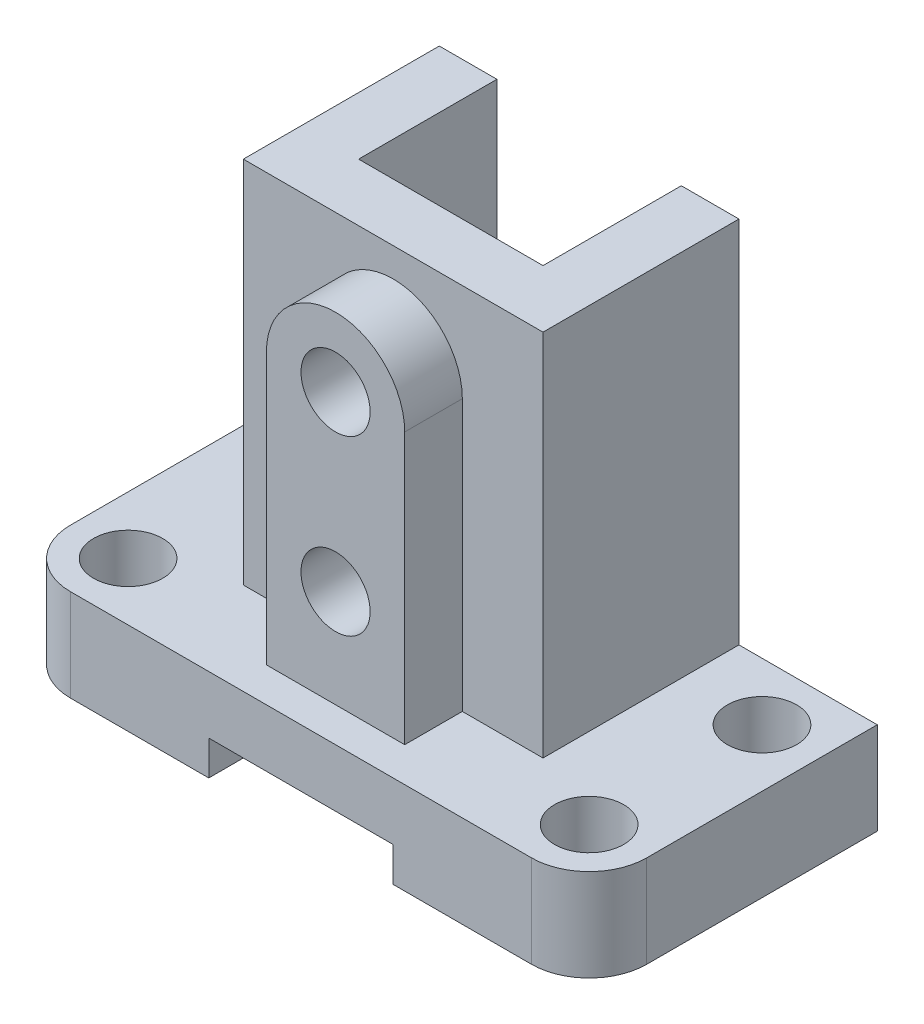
SolidWorks part; units mm, degrees
ref_plane "前视基准面" through (0, 0, 0) normal (0, 0, 1) x (1, 0, 0)
ref_plane "上视基准面" through (0, 0, 0) normal (0, 1, 0) x (1, 0, 0)
ref_plane "右视基准面" through (0, 0, 0) normal (1, 0, 0) x (0, 0, -1)
sketch "草图1" plane through (0, 0, 0) normal (0, 1, 0) x (1, 0, 0)
  line L0 (-24.746, -4.513) -> (34.5172, -4.513) construction
  line L1 (-100, 45.487) -> (100, 45.487)
  line L2 (-100, 45.487) -> (-100, -34.513)
  line L3 (-80, -54.513) -> (80, -54.513)
  line L4 (100, 45.487) -> (100, -34.513)
  line L5 (0, 32.2774) -> (0, -29.7669) construction
  arc A0 (80, -54.513) -> (100, -34.513) centre (80, -34.513) ccw
  arc A1 (-80, -54.513) -> (-100, -34.513) centre (-80, -34.513) cw
  point P11 (100, -54.513)
  point P14 (-100, -54.513)
  dimension "D3" = 20
  dimension "D1" = 100
  dimension "D2" = 200
extrude "拉伸1" add sketch "草图1" along normal blind 32
sketch "草图2" plane through (0, 32, 0) normal (0, 1, 0) x (1, 0, 0)
  circle A0 centre (80, -34.513) radius 12
  circle A1 centre (80, 25.487) radius 12
  dimension "D1" = 60
extrude "切除-拉伸1" cut sketch "草图2" against normal through all
mirror "镜向1" about plane through (0, 0, 0) normal (1, 0, 0) of "切除-拉伸1"
sketch "草图3" plane through (0, 32, 0) normal (0, 1, 0) x (1, 0, 0)
  line L0 (-52, 45.487) -> (-52, -22.513)
  line L1 (100, 45.487) -> (-100, 45.487) construction
  line L2 (-52, -22.513) -> (52, -22.513)
  line L3 (52, -22.513) -> (52, 45.487)
  line L4 (-32, 45.487) -> (-32, -2.513)
  line L5 (-32, -2.513) -> (32, -2.513)
  line L6 (32, -2.513) -> (32, 45.487)
  line L7 (-52, 45.487) -> (-32, 45.487)
  line L8 (32, 45.487) -> (52, 45.487)
  line L9 (0, 17.4509) -> (0, 38.1483) construction
  dimension "D1" = 68
  dimension "D2" = 104
  dimension "D3" = 20
extrude "拉伸2" add sketch "草图3" along normal blind 128
sketch "草图4" plane through (0, 32, 0) normal (0, 1, 0) x (1, 0, 0)
  line L1 (-32, 45.487) -> (32, 45.487)
  line L2 (-32, 45.487) -> (-32, -2.513)
  line L3 (-32, -2.513) -> (32, -2.513)
  line L4 (32, 45.487) -> (32, -2.513)
extrude "切除-拉伸2" cut sketch "草图4" against normal through all
sketch "草图5" plane through (0, 0, 22.513) normal (0, 0, 1) x (1, 0, 0)
  line L0 (-24, 32) -> (-24, 126)
  line L1 (-80, 32) -> (80, 32) construction
  line L2 (24, 126) -> (24, 32)
  line L3 (24, 32) -> (-24, 32)
  arc A0 (-24, 126) -> (24, 126) centre (0, 126) cw
  dimension "D1" = 48
  dimension "D2" = 94
extrude "拉伸3" add sketch "草图5" along normal blind 20
sketch "草图6" plane through (0, 0, 42.513) normal (0, 0, 1) x (1, 0, 0)
  circle A0 centre (0, 126) radius 12
  circle A1 centre (0, 66) radius 12
  dimension "D1" = 60
extrude "切除-拉伸3" cut sketch "草图6" against normal through all
sketch "草图7" plane through (0, 0, 54.513) normal (0, 0, 1) x (1, 0, 0)
  line L0 (0, -15.9362) -> (0, -42.9821) construction
  line L1 (-32, 12) -> (32, 12)
  line L2 (-32, 12) -> (-32, -8.003)
  line L3 (-32, -8.003) -> (32, -8.003)
  line L4 (32, 12) -> (32, -8.003)
  line L5 (-80, 0) -> (80, 0) construction
  dimension "D1" = 64
  dimension "D2" = 12
extrude "切除-拉伸4" cut sketch "草图7" against normal through all
